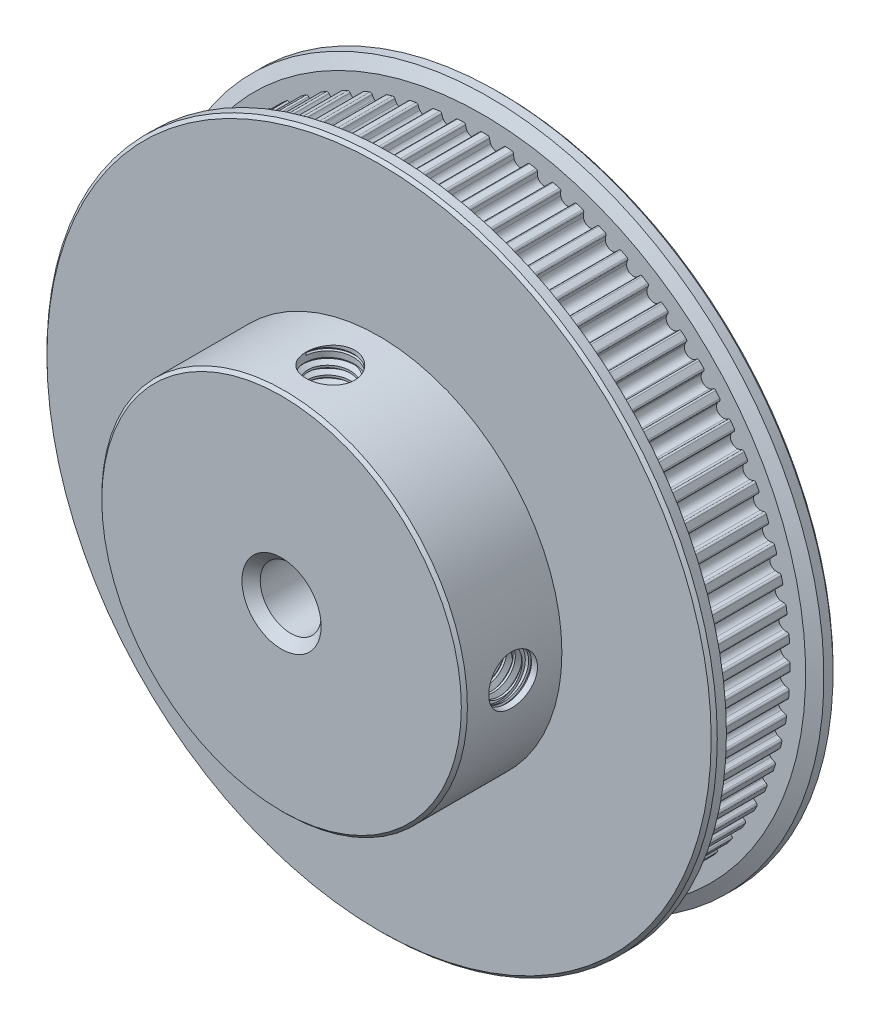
SolidWorks part; units mm, degrees
other "Markup1"
sketch "Sketch5" plane through (27.5, 27.5, 15) normal (0.951, 0.3087, 0.0178) x (0.0998, -0.2518, -0.9626)
ref_plane "Front Plane" through (0, 0, 0) normal (0, 0, 1) x (1, 0, 0)
ref_plane "Top Plane" through (0, 0, 0) normal (0, 1, 0) x (1, 0, 0)
ref_plane "Right Plane" through (0, 0, 0) normal (1, 0, 0) x (0, 0, -1)
sketch "Sketch1" plane through (0, 0, 0) normal (0, 0, 1) x (1, 0, 0)
  circle B0 centre (0, 0) radius 2.5
  arc B1 (17.8991, -17.7708) -> (17.9055, -17.573) centre (17.7897, -17.6683) ccw
  arc B2 (17.7274, -17.2894) -> (17.9055, -17.573) centre (18.6514, -16.9069) ccw
  arc B3 (17.843, -16.7174) -> (17.7274, -17.2894) centre (18.248, -17.0968) ccw
  arc B4 (18.4062, -16.5649) -> (17.843, -16.7174) centre (18.248, -17.0968) ccw
  arc B5 (18.7008, -16.7241) -> (18.4062, -16.5649) centre (18.0847, -17.5118) ccw
  arc B6 (18.7008, -16.7241) -> (18.8978, -16.7049) centre (18.7884, -16.6023) ccw
  arc B7 (18.8978, -16.7049) -> (19.2382, -16.3117) centre (0.0089, -0.0077) ccw
  arc B8 (19.2382, -16.3117) -> (19.2291, -16.114) centre (19.1211, -16.218) ccw
  arc B9 (19.0293, -15.8452) -> (19.2291, -16.114) centre (19.9204, -15.3914) ccw
  arc B10 (19.0996, -15.2659) -> (19.0293, -15.8452) centre (19.5331, -15.6124) ccw
  arc B11 (19.6492, -15.0697) -> (19.0996, -15.2659) centre (19.5331, -15.6124) ccw
  arc B12 (19.9553, -15.2053) -> (19.6492, -15.0697) centre (19.4029, -16.0389) ccw
  arc B13 (19.9553, -15.2053) -> (20.1502, -15.1707) centre (20.0331, -15.077) ccw
  arc B14 (20.1502, -15.1707) -> (20.4587, -14.752) centre (0.0095, -0.007) ccw
  arc B15 (20.4587, -14.752) -> (20.4341, -14.5556) centre (20.3346, -14.6678) ccw
  arc B16 (20.2138, -14.3033) -> (20.4341, -14.5556) centre (21.0666, -13.781) ccw
  arc B17 (20.2385, -13.7203) -> (20.2138, -14.3033) centre (20.6978, -14.0317) ccw
  arc B18 (20.7709, -13.4816) -> (20.2385, -13.7203) centre (20.6978, -14.0317) ccw
  arc B19 (21.0868, -13.5928) -> (20.7709, -13.4816) centre (20.6015, -14.4671) ccw
  arc B20 (21.0868, -13.5928) -> (21.2784, -13.5429) centre (21.1542, -13.4588) ccw
  arc B21 (21.2784, -13.5429) -> (21.5531, -13.1013) centre (0.0101, -0.0063) ccw
  arc B22 (21.5531, -13.1013) -> (21.5131, -12.9075) centre (21.4227, -13.0272) ccw
  arc B23 (21.2738, -12.6733) -> (21.5131, -12.9075) centre (22.0829, -12.0857) ccw
  arc B24 (21.2525, -12.0901) -> (21.2738, -12.6733) centre (21.7349, -12.3645) ccw
  arc B25 (21.7647, -11.8103) -> (21.2525, -12.0901) centre (21.7349, -12.3645) ccw
  arc B26 (22.0883, -11.8964) -> (21.7647, -11.8103) centre (21.673, -12.8061) ccw
  arc B27 (22.0883, -11.8964) -> (22.2754, -11.8317) centre (22.145, -11.7575) ccw
  arc B28 (22.2754, -11.8317) -> (22.5146, -11.3699) centre (0.0105, -0.0054) ccw
  arc B29 (22.5146, -11.3699) -> (22.4595, -11.1798) centre (22.3788, -11.3062) ccw
  arc B30 (22.2025, -10.9651) -> (22.4595, -11.1798) centre (22.963, -10.3158) ccw
  arc B31 (22.1356, -10.3854) -> (22.2025, -10.9651) centre (22.6381, -10.6211) ccw
  arc B32 (22.6242, -10.0663) -> (22.1356, -10.3854) centre (22.6381, -10.6211) ccw
  arc B33 (22.9536, -10.1267) -> (22.6242, -10.0663) centre (22.611, -11.0662) ccw
  arc B34 (22.9536, -10.1267) -> (23.135, -10.0475) centre (22.9992, -9.9838) ccw
  arc B35 (23.135, -10.0475) -> (23.3372, -9.5684) centre (0.0109, -0.0046) ccw
  arc B36 (23.3372, -9.5684) -> (23.2674, -9.3832) centre (23.1969, -9.5155) ccw
  arc B37 (22.9944, -9.1893) -> (23.2674, -9.3832) centre (23.7016, -8.4823) ccw
  arc B38 (22.8822, -8.6166) -> (22.9944, -9.1893) centre (23.4016, -8.8122) ccw
  arc B39 (23.3442, -8.2602) -> (22.8822, -8.6166) centre (23.4016, -8.8122) ccw
  arc B40 (23.6774, -8.2946) -> (23.3442, -8.2602) centre (23.4095, -9.258) ccw
  arc B41 (23.6774, -8.2946) -> (23.852, -8.2014) centre (23.7116, -8.1485) ccw
  arc B42 (23.852, -8.2014) -> (24.016, -7.7079) centre (0.0112, -0.0037) ccw
  arc B43 (24.016, -7.7079) -> (23.9319, -7.5287) centre (23.8719, -7.6662) ccw
  arc B44 (23.6445, -7.3569) -> (23.9319, -7.5287) centre (24.2941, -6.5966) ccw
  arc B45 (23.4877, -6.7947) -> (23.6445, -7.3569) centre (24.0209, -6.949) ccw
  arc B46 (23.9204, -6.4031) -> (23.4877, -6.7947) centre (24.0209, -6.949) ccw
  arc B47 (24.2552, -6.4113) -> (23.9204, -6.4031) centre (24.0637, -7.3928) ccw
  arc B48 (24.2552, -6.4113) -> (24.4219, -6.3047) centre (24.2779, -6.263) ccw
  arc B49 (24.4219, -6.3047) -> (24.5467, -5.7998) centre (0.0115, -0.0028) ccw
  arc B50 (24.5467, -5.7998) -> (24.4488, -5.6278) centre (24.3998, -5.7696) ccw
  arc B51 (24.1488, -5.4791) -> (24.4488, -5.6278) centre (24.7367, -4.6702) ccw
  arc B52 (23.9484, -4.931) -> (24.1488, -5.4791) centre (24.492, -5.0429) ccw
  arc B53 (24.349, -4.5066) -> (23.9484, -4.931) centre (24.492, -5.0429) ccw
  arc B54 (24.6834, -4.4885) -> (24.349, -4.5066) centre (24.5696, -5.482) ccw
  arc B55 (24.6834, -4.4885) -> (24.8413, -4.3692) centre (24.6944, -4.3389) ccw
  arc B56 (24.8413, -4.3692) -> (24.9261, -3.856) centre (0.0117, -0.0019) ccw
  arc B57 (24.9261, -3.856) -> (24.815, -3.6922) centre (24.7773, -3.8374) ccw
  arc B58 (24.5042, -3.5675) -> (24.815, -3.6922) centre (25.0269, -2.7149) ccw
  arc B59 (24.2615, -3.0368) -> (24.5042, -3.5675) centre (24.8122, -3.1057) ccw
  arc B60 (24.6275, -2.5823) -> (24.2615, -3.0368) centre (24.8122, -3.1057) ccw
  arc B61 (24.9595, -2.538) -> (24.6275, -2.5823) centre (24.924, -3.5374) ccw
  arc B62 (24.9595, -2.538) -> (25.1075, -2.4067) centre (24.9587, -2.388) ccw
  arc B63 (25.1075, -2.4067) -> (25.1518, -1.8885) centre (0.0118, -0.001) ccw
  arc B64 (25.1518, -1.8885) -> (25.0282, -1.7339) centre (25.002, -1.8816) ccw
  arc B65 (24.7086, -1.6339) -> (25.0282, -1.7339) centre (25.1628, -0.743) ccw
  arc B66 (24.4249, -1.1239) -> (24.7086, -1.6339) centre (24.9794, -1.1494) ccw
  arc B67 (24.7542, -0.6421) -> (24.4249, -1.1239) centre (24.9794, -1.1494) ccw
  arc B68 (25.0817, -0.5719) -> (24.7542, -0.6421) centre (25.1247, -1.571) ccw
  arc B69 (25.0817, -0.5719) -> (25.219, -0.4293) centre (25.0691, -0.4224) ccw
  arc B70 (25.219, -0.4293) -> (25.2225, 0.0907) centre (0.0118, -0.0001) ccw
  arc B71 (25.2225, 0.0907) -> (25.0871, 0.2352) centre (25.0725, 0.0859) ccw
  arc B72 (24.7606, 0.3098) -> (25.0871, 0.2352) centre (25.1435, 1.2336) ccw
  arc B73 (24.4378, 0.7959) -> (24.7606, 0.3098) centre (24.9925, 0.814) ccw
  arc B74 (24.7283, 1.302) -> (24.4378, 0.7959) centre (24.9925, 0.814) ccw
  arc B75 (25.0492, 1.3977) -> (24.7283, 1.302) centre (25.1705, 0.4051) ccw
  arc B76 (25.0492, 1.3977) -> (25.1749, 1.5507) centre (25.025, 1.5458) ccw
  arc B77 (25.1749, 1.5507) -> (25.1376, 2.0694) centre (0.0118, 0.0008) ccw
  arc B78 (25.1376, 2.0694) -> (24.9913, 2.2027) centre (24.9885, 2.0528) ccw
  arc B79 (24.66, 2.2515) -> (24.9913, 2.2027) centre (24.9692, 3.2025) ccw
  arc B80 (24.3001, 2.7108) -> (24.66, 2.2515) centre (24.8516, 2.7724) ccw
  arc B81 (24.5499, 3.2382) -> (24.3001, 2.7108) centre (24.8516, 2.7724) ccw
  arc B82 (24.8623, 3.3588) -> (24.5499, 3.2382) centre (25.0611, 2.3787) ccw
  arc B83 (24.8623, 3.3588) -> (24.9756, 3.5211) centre (24.8266, 3.5044) ccw
  arc B84 (24.9756, 3.5211) -> (24.8977, 4.0353) centre (0.0117, 0.0018) ccw
  arc B85 (24.8977, 4.0353) -> (24.7414, 4.1567) centre (24.7504, 4.007) ccw
  arc B86 (24.4073, 4.1794) -> (24.7414, 4.1567) centre (24.641, 5.1517) ccw
  arc B87 (24.0125, 4.609) -> (24.4073, 4.1794) centre (24.5575, 4.7137) ccw
  arc B88 (24.2202, 5.1544) -> (24.0125, 4.609) centre (24.5575, 4.7137) ccw
  arc B89 (24.5222, 5.2991) -> (24.2202, 5.1544) centre (24.7972, 4.3377) ccw
  arc B90 (24.5222, 5.2991) -> (24.6224, 5.4698) centre (24.4751, 5.4415) ccw
  arc B91 (24.6224, 5.4698) -> (24.5044, 5.9763) centre (0.0115, 0.0027) ccw
  arc B92 (24.5044, 5.9763) -> (24.339, 6.0851) centre (24.3597, 5.9366) ccw
  arc B93 (24.0042, 6.0815) -> (24.339, 6.0851) centre (24.1608, 7.0691) ccw
  arc B94 (23.5768, 6.4788) -> (24.0042, 6.0815) centre (24.112, 6.6259) ccw
  arc B95 (23.7411, 7.0388) -> (23.5768, 6.4788) centre (24.112, 6.6259) ccw
  arc B96 (24.0308, 7.2067) -> (23.7411, 7.0388) centre (24.3804, 6.2699) ccw
  arc B97 (24.0308, 7.2067) -> (24.1173, 7.3848) centre (23.9727, 7.345) ccw
  arc B98 (24.1173, 7.3848) -> (23.9599, 7.8805) centre (0.0113, 0.0036) ccw
  arc B99 (23.9599, 7.8805) -> (23.7866, 7.976) centre (23.8189, 7.8295) ccw
  arc B100 (23.453, 7.9461) -> (23.7866, 7.976) centre (23.5317, 8.943) ccw
  arc B101 (22.9958, 8.3087) -> (23.453, 7.9461) centre (23.5178, 8.4973) ccw
  arc B102 (23.1157, 8.8798) -> (22.9958, 8.3087) centre (23.5178, 8.4973) ccw
  arc B103 (23.3913, 9.07) -> (23.1157, 8.8798) centre (23.8134, 8.1634) ccw
  arc B104 (23.3913, 9.07) -> (23.4636, 9.2542) centre (23.3225, 9.2033) ccw
  arc B105 (23.4636, 9.2542) -> (23.2678, 9.7361) centre (0.011, 0.0045) ccw
  arc B106 (23.2678, 9.7361) -> (23.0875, 9.8177) centre (23.1312, 9.6742) ccw
  arc B107 (22.7573, 9.7617) -> (23.0875, 9.8177) centre (22.7575, 10.7617) ccw
  arc B108 (22.273, 10.0873) -> (22.7573, 9.7617) centre (22.7786, 10.3163) ccw
  arc B109 (22.3477, 10.666) -> (22.273, 10.0873) centre (22.7786, 10.3163) ccw
  arc B110 (22.6076, 10.8773) -> (22.3477, 10.666) centre (23.0995, 10.0066) ccw
  arc B111 (22.6076, 10.8773) -> (22.6652, 11.0666) centre (22.5285, 11.0048) ccw
  arc B112 (22.6652, 11.0666) -> (22.4322, 11.5316) centre (0.0106, 0.0053) ccw
  arc B113 (22.4322, 11.5316) -> (22.246, 11.5988) centre (22.3008, 11.4592) ccw
  arc B114 (21.9213, 11.5171) -> (22.246, 11.5988) centre (21.843, 12.514) ccw
  arc B115 (21.4129, 11.8037) -> (21.9213, 11.5171) centre (21.899, 12.0716) ccw
  arc B116 (21.442, 12.3865) -> (21.4129, 11.8037) centre (21.899, 12.0716) ccw
  arc B117 (21.6845, 12.6175) -> (21.442, 12.3865) centre (22.2431, 11.7881) ccw
  arc B118 (21.6845, 12.6175) -> (21.727, 12.8108) centre (21.5957, 12.7384) ccw
  arc B119 (21.727, 12.8108) -> (21.4583, 13.2561) centre (0.0101, 0.0061) ccw
  arc B120 (21.4583, 13.2561) -> (21.2674, 13.3085) centre (21.333, 13.1736) ccw
  arc B121 (20.9501, 13.2015) -> (21.2674, 13.3085) centre (20.7938, 14.1892) ccw
  arc B122 (20.4208, 13.4474) -> (20.9501, 13.2015) centre (20.8843, 13.7526) ccw
  arc B123 (20.404, 14.0307) -> (20.4208, 13.4474) centre (20.8843, 13.7526) ccw
  arc B124 (20.6277, 14.28) -> (20.404, 14.0307) centre (21.2497, 13.497) ccw
  arc B125 (20.6277, 14.28) -> (20.6549, 14.476) centre (20.5297, 14.3935) ccw
  arc B126 (20.6549, 14.476) -> (20.3521, 14.8988) centre (0.0096, 0.0069) ccw
  arc B127 (20.3521, 14.8988) -> (20.1577, 14.9361) centre (20.2336, 14.8067) ccw
  arc B128 (19.8497, 14.8045) -> (20.1577, 14.9361) centre (19.6164, 15.7769) ccw
  arc B129 (19.3028, 15.0081) -> (19.8497, 14.8045) centre (19.7409, 15.3488) ccw
  arc B130 (19.2403, 15.5883) -> (19.3028, 15.0081) centre (19.7409, 15.3488) ccw
  arc B131 (19.4437, 15.8544) -> (19.2403, 15.5883) centre (20.1252, 15.1226) ccw
  arc B132 (19.4437, 15.8544) -> (19.4555, 16.0519) centre (19.3371, 15.9599) ccw
  arc B133 (19.4555, 16.0519) -> (19.1204, 16.4497) centre (0.0091, 0.0076) ccw
  arc B134 (19.1204, 16.4497) -> (18.9237, 16.4716) centre (19.0095, 16.3486) ccw
  arc B135 (18.627, 16.3163) -> (18.9237, 16.4716) centre (18.3181, 17.2674) ccw
  arc B136 (18.0658, 16.4763) -> (18.627, 16.3163) centre (18.4758, 16.8503) ccw
  arc B137 (17.9579, 17.0498) -> (18.0658, 16.4763) centre (18.4758, 16.8503) ccw
  arc B138 (18.1398, 17.331) -> (17.9579, 17.0498) centre (18.8767, 16.655) ccw
  arc B139 (18.1398, 17.331) -> (18.1361, 17.5289) centre (18.0253, 17.4278) ccw
  arc B140 (18.1361, 17.5289) -> (17.7708, 17.8991) centre (0.0084, 0.0083) ccw
  arc B141 (17.7708, 17.8991) -> (17.573, 17.9055) centre (17.6683, 17.7897) ccw
  arc B142 (17.2894, 17.7274) -> (17.573, 17.9055) centre (16.9069, 18.6514) ccw
  arc B143 (16.7174, 17.843) -> (17.2894, 17.7274) centre (17.0968, 18.248) ccw
  arc B144 (16.5649, 18.4062) -> (16.7174, 17.843) centre (17.0968, 18.248) ccw
  arc B145 (16.7241, 18.7008) -> (16.5649, 18.4062) centre (17.5118, 18.0847) ccw
  arc B146 (16.7241, 18.7008) -> (16.7049, 18.8978) centre (16.6023, 18.7884) ccw
  arc B147 (16.7049, 18.8978) -> (16.3117, 19.2382) centre (0.0077, 0.0089) ccw
  arc B148 (16.3117, 19.2382) -> (16.114, 19.2291) centre (16.218, 19.1211) ccw
  arc B149 (15.8452, 19.0293) -> (16.114, 19.2291) centre (15.3914, 19.9204) ccw
  arc B150 (15.2659, 19.0996) -> (15.8452, 19.0293) centre (15.6124, 19.5331) ccw
  arc B151 (15.0697, 19.6492) -> (15.2659, 19.0996) centre (15.6124, 19.5331) ccw
  arc B152 (15.2053, 19.9553) -> (15.0697, 19.6492) centre (16.0389, 19.4029) ccw
  arc B153 (15.2053, 19.9553) -> (15.1707, 20.1502) centre (15.077, 20.0331) ccw
  arc B154 (15.1707, 20.1502) -> (14.752, 20.4587) centre (0.007, 0.0095) ccw
  arc B155 (14.752, 20.4587) -> (14.5556, 20.4341) centre (14.6678, 20.3346) ccw
  arc B156 (14.3033, 20.2138) -> (14.5556, 20.4341) centre (13.781, 21.0666) ccw
  arc B157 (13.7203, 20.2385) -> (14.3033, 20.2138) centre (14.0317, 20.6978) ccw
  arc B158 (13.4816, 20.7709) -> (13.7203, 20.2385) centre (14.0317, 20.6978) ccw
  arc B159 (13.5928, 21.0868) -> (13.4816, 20.7709) centre (14.4671, 20.6015) ccw
  arc B160 (13.5928, 21.0868) -> (13.5429, 21.2784) centre (13.4588, 21.1542) ccw
  arc B161 (13.5429, 21.2784) -> (13.1013, 21.5531) centre (0.0063, 0.0101) ccw
  arc B162 (13.1013, 21.5531) -> (12.9075, 21.5131) centre (13.0272, 21.4227) ccw
  arc B163 (12.6733, 21.2738) -> (12.9075, 21.5131) centre (12.0857, 22.0829) ccw
  arc B164 (12.0901, 21.2525) -> (12.6733, 21.2738) centre (12.3645, 21.7349) ccw
  arc B165 (11.8103, 21.7647) -> (12.0901, 21.2525) centre (12.3645, 21.7349) ccw
  arc B166 (11.8964, 22.0883) -> (11.8103, 21.7647) centre (12.8061, 21.673) ccw
  arc B167 (11.8964, 22.0883) -> (11.8317, 22.2754) centre (11.7575, 22.145) ccw
  arc B168 (11.8317, 22.2754) -> (11.3699, 22.5146) centre (0.0054, 0.0105) ccw
  arc B169 (11.3699, 22.5146) -> (11.1798, 22.4595) centre (11.3062, 22.3788) ccw
  arc B170 (10.9651, 22.2025) -> (11.1798, 22.4595) centre (10.3158, 22.963) ccw
  arc B171 (10.3854, 22.1356) -> (10.9651, 22.2025) centre (10.6211, 22.6381) ccw
  arc B172 (10.0663, 22.6242) -> (10.3854, 22.1356) centre (10.6211, 22.6381) ccw
  arc B173 (10.1267, 22.9536) -> (10.0663, 22.6242) centre (11.0662, 22.611) ccw
  arc B174 (10.1267, 22.9536) -> (10.0475, 23.135) centre (9.9838, 22.9992) ccw
  arc B175 (10.0475, 23.135) -> (9.5684, 23.3372) centre (0.0046, 0.0109) ccw
  arc B176 (9.5684, 23.3372) -> (9.3832, 23.2674) centre (9.5155, 23.1969) ccw
  arc B177 (9.1893, 22.9944) -> (9.3832, 23.2674) centre (8.4823, 23.7016) ccw
  arc B178 (8.6166, 22.8822) -> (9.1893, 22.9944) centre (8.8122, 23.4016) ccw
  arc B179 (8.2602, 23.3442) -> (8.6166, 22.8822) centre (8.8122, 23.4016) ccw
  arc B180 (8.2946, 23.6774) -> (8.2602, 23.3442) centre (9.258, 23.4095) ccw
  arc B181 (8.2946, 23.6774) -> (8.2014, 23.852) centre (8.1485, 23.7116) ccw
  arc B182 (8.2014, 23.852) -> (7.7079, 24.016) centre (0.0037, 0.0112) ccw
  arc B183 (7.7079, 24.016) -> (7.5287, 23.9319) centre (7.6662, 23.8719) ccw
  arc B184 (7.3569, 23.6445) -> (7.5287, 23.9319) centre (6.5966, 24.2941) ccw
  arc B185 (6.7947, 23.4877) -> (7.3569, 23.6445) centre (6.949, 24.0209) ccw
  arc B186 (6.4031, 23.9204) -> (6.7947, 23.4877) centre (6.949, 24.0209) ccw
  arc B187 (6.4113, 24.2552) -> (6.4031, 23.9204) centre (7.3928, 24.0637) ccw
  arc B188 (6.4113, 24.2552) -> (6.3047, 24.4219) centre (6.263, 24.2779) ccw
  arc B189 (6.3047, 24.4219) -> (5.7998, 24.5467) centre (0.0028, 0.0115) ccw
  arc B190 (5.7998, 24.5467) -> (5.6278, 24.4488) centre (5.7696, 24.3998) ccw
  arc B191 (5.4791, 24.1488) -> (5.6278, 24.4488) centre (4.6702, 24.7367) ccw
  arc B192 (4.931, 23.9484) -> (5.4791, 24.1488) centre (5.0429, 24.492) ccw
  arc B193 (4.5066, 24.349) -> (4.931, 23.9484) centre (5.0429, 24.492) ccw
  arc B194 (4.4885, 24.6834) -> (4.5066, 24.349) centre (5.482, 24.5696) ccw
  arc B195 (4.4885, 24.6834) -> (4.3692, 24.8413) centre (4.3389, 24.6944) ccw
  arc B196 (4.3692, 24.8413) -> (3.856, 24.9261) centre (0.0019, 0.0117) ccw
  arc B197 (3.856, 24.9261) -> (3.6922, 24.815) centre (3.8374, 24.7773) ccw
  arc B198 (3.5675, 24.5042) -> (3.6922, 24.815) centre (2.7149, 25.0269) ccw
  arc B199 (3.0368, 24.2615) -> (3.5675, 24.5042) centre (3.1057, 24.8122) ccw
  arc B200 (2.5823, 24.6275) -> (3.0368, 24.2615) centre (3.1057, 24.8122) ccw
  arc B201 (2.538, 24.9595) -> (2.5823, 24.6275) centre (3.5374, 24.924) ccw
  arc B202 (2.538, 24.9595) -> (2.4067, 25.1075) centre (2.388, 24.9587) ccw
  arc B203 (2.4067, 25.1075) -> (1.8885, 25.1518) centre (0.001, 0.0118) ccw
  arc B204 (1.8885, 25.1518) -> (1.7339, 25.0282) centre (1.8816, 25.002) ccw
  arc B205 (1.6339, 24.7086) -> (1.7339, 25.0282) centre (0.743, 25.1628) ccw
  arc B206 (1.1239, 24.4249) -> (1.6339, 24.7086) centre (1.1494, 24.9794) ccw
  arc B207 (0.6421, 24.7542) -> (1.1239, 24.4249) centre (1.1494, 24.9794) ccw
  arc B208 (0.5719, 25.0817) -> (0.6421, 24.7542) centre (1.571, 25.1247) ccw
  arc B209 (0.5719, 25.0817) -> (0.4293, 25.219) centre (0.4224, 25.0691) ccw
  arc B210 (0.4293, 25.219) -> (-0.0907, 25.2225) centre (0.0001, 0.0118) ccw
  arc B211 (-0.0907, 25.2225) -> (-0.2352, 25.0871) centre (-0.0859, 25.0725) ccw
  arc B212 (-0.3098, 24.7606) -> (-0.2352, 25.0871) centre (-1.2336, 25.1435) ccw
  arc B213 (-0.7959, 24.4378) -> (-0.3098, 24.7606) centre (-0.814, 24.9925) ccw
  arc B214 (-1.302, 24.7283) -> (-0.7959, 24.4378) centre (-0.814, 24.9925) ccw
  arc B215 (-1.3977, 25.0492) -> (-1.302, 24.7283) centre (-0.4051, 25.1705) ccw
  arc B216 (-1.3977, 25.0492) -> (-1.5507, 25.1749) centre (-1.5458, 25.025) ccw
  arc B217 (-1.5507, 25.1749) -> (-2.0694, 25.1376) centre (-0.0008, 0.0118) ccw
  arc B218 (-2.0694, 25.1376) -> (-2.2027, 24.9913) centre (-2.0528, 24.9885) ccw
  arc B219 (-2.2515, 24.66) -> (-2.2027, 24.9913) centre (-3.2025, 24.9692) ccw
  arc B220 (-2.7108, 24.3001) -> (-2.2515, 24.66) centre (-2.7724, 24.8516) ccw
  arc B221 (-3.2382, 24.5499) -> (-2.7108, 24.3001) centre (-2.7724, 24.8516) ccw
  arc B222 (-3.3588, 24.8623) -> (-3.2382, 24.5499) centre (-2.3787, 25.0611) ccw
  arc B223 (-3.3588, 24.8623) -> (-3.5211, 24.9756) centre (-3.5044, 24.8266) ccw
  arc B224 (-3.5211, 24.9756) -> (-4.0353, 24.8977) centre (-0.0018, 0.0117) ccw
  arc B225 (-4.0353, 24.8977) -> (-4.1567, 24.7414) centre (-4.007, 24.7504) ccw
  arc B226 (-4.1794, 24.4073) -> (-4.1567, 24.7414) centre (-5.1517, 24.641) ccw
  arc B227 (-4.609, 24.0125) -> (-4.1794, 24.4073) centre (-4.7137, 24.5575) ccw
  arc B228 (-5.1544, 24.2202) -> (-4.609, 24.0125) centre (-4.7137, 24.5575) ccw
  arc B229 (-5.2991, 24.5222) -> (-5.1544, 24.2202) centre (-4.3377, 24.7972) ccw
  arc B230 (-5.2991, 24.5222) -> (-5.4698, 24.6224) centre (-5.4415, 24.4751) ccw
  arc B231 (-5.4698, 24.6224) -> (-5.9763, 24.5044) centre (-0.0027, 0.0115) ccw
  arc B232 (-5.9763, 24.5044) -> (-6.0851, 24.339) centre (-5.9366, 24.3597) ccw
  arc B233 (-6.0815, 24.0042) -> (-6.0851, 24.339) centre (-7.0691, 24.1608) ccw
  arc B234 (-6.4788, 23.5768) -> (-6.0815, 24.0042) centre (-6.6259, 24.112) ccw
  arc B235 (-7.0388, 23.7411) -> (-6.4788, 23.5768) centre (-6.6259, 24.112) ccw
  arc B236 (-7.2067, 24.0308) -> (-7.0388, 23.7411) centre (-6.2699, 24.3804) ccw
  arc B237 (-7.2067, 24.0308) -> (-7.3848, 24.1173) centre (-7.345, 23.9727) ccw
  arc B238 (-7.3848, 24.1173) -> (-7.8805, 23.9599) centre (-0.0036, 0.0113) ccw
  arc B239 (-7.8805, 23.9599) -> (-7.976, 23.7866) centre (-7.8295, 23.8189) ccw
  arc B240 (-7.9461, 23.453) -> (-7.976, 23.7866) centre (-8.943, 23.5317) ccw
  arc B241 (-8.3087, 22.9958) -> (-7.9461, 23.453) centre (-8.4973, 23.5178) ccw
  arc B242 (-8.8798, 23.1157) -> (-8.3087, 22.9958) centre (-8.4973, 23.5178) ccw
  arc B243 (-9.07, 23.3913) -> (-8.8798, 23.1157) centre (-8.1634, 23.8134) ccw
  arc B244 (-9.07, 23.3913) -> (-9.2542, 23.4636) centre (-9.2033, 23.3225) ccw
  arc B245 (-9.2542, 23.4636) -> (-9.7361, 23.2678) centre (-0.0045, 0.011) ccw
  arc B246 (-9.7361, 23.2678) -> (-9.8177, 23.0875) centre (-9.6742, 23.1312) ccw
  arc B247 (-9.7617, 22.7573) -> (-9.8177, 23.0875) centre (-10.7617, 22.7575) ccw
  arc B248 (-10.0873, 22.273) -> (-9.7617, 22.7573) centre (-10.3163, 22.7786) ccw
  arc B249 (-10.666, 22.3477) -> (-10.0873, 22.273) centre (-10.3163, 22.7786) ccw
  arc B250 (-10.8773, 22.6076) -> (-10.666, 22.3477) centre (-10.0066, 23.0995) ccw
  arc B251 (-10.8773, 22.6076) -> (-11.0666, 22.6652) centre (-11.0048, 22.5285) ccw
  arc B252 (-11.0666, 22.6652) -> (-11.5316, 22.4322) centre (-0.0053, 0.0106) ccw
  arc B253 (-11.5316, 22.4322) -> (-11.5988, 22.246) centre (-11.4592, 22.3008) ccw
  arc B254 (-11.5171, 21.9213) -> (-11.5988, 22.246) centre (-12.514, 21.843) ccw
  arc B255 (-11.8037, 21.4129) -> (-11.5171, 21.9213) centre (-12.0716, 21.899) ccw
  arc B256 (-12.3865, 21.442) -> (-11.8037, 21.4129) centre (-12.0716, 21.899) ccw
  arc B257 (-12.6175, 21.6845) -> (-12.3865, 21.442) centre (-11.7881, 22.2431) ccw
  arc B258 (-12.6175, 21.6845) -> (-12.8108, 21.727) centre (-12.7384, 21.5957) ccw
  arc B259 (-12.8108, 21.727) -> (-13.2561, 21.4583) centre (-0.0061, 0.0101) ccw
  arc B260 (-13.2561, 21.4583) -> (-13.3085, 21.2674) centre (-13.1736, 21.333) ccw
  arc B261 (-13.2015, 20.9501) -> (-13.3085, 21.2674) centre (-14.1892, 20.7938) ccw
  arc B262 (-13.4474, 20.4208) -> (-13.2015, 20.9501) centre (-13.7526, 20.8843) ccw
  arc B263 (-14.0307, 20.404) -> (-13.4474, 20.4208) centre (-13.7526, 20.8843) ccw
  arc B264 (-14.28, 20.6277) -> (-14.0307, 20.404) centre (-13.497, 21.2497) ccw
  arc B265 (-14.28, 20.6277) -> (-14.476, 20.6549) centre (-14.3935, 20.5297) ccw
  arc B266 (-14.476, 20.6549) -> (-14.8988, 20.3521) centre (-0.0069, 0.0096) ccw
  arc B267 (-14.8988, 20.3521) -> (-14.9361, 20.1577) centre (-14.8067, 20.2336) ccw
  arc B268 (-14.8045, 19.8497) -> (-14.9361, 20.1577) centre (-15.7769, 19.6164) ccw
  arc B269 (-15.0081, 19.3028) -> (-14.8045, 19.8497) centre (-15.3488, 19.7409) ccw
  arc B270 (-15.5883, 19.2403) -> (-15.0081, 19.3028) centre (-15.3488, 19.7409) ccw
  arc B271 (-15.8544, 19.4437) -> (-15.5883, 19.2403) centre (-15.1226, 20.1252) ccw
  arc B272 (-15.8544, 19.4437) -> (-16.0519, 19.4555) centre (-15.9599, 19.3371) ccw
  arc B273 (-16.0519, 19.4555) -> (-16.4497, 19.1204) centre (-0.0076, 0.0091) ccw
  arc B274 (-16.4497, 19.1204) -> (-16.4716, 18.9237) centre (-16.3486, 19.0095) ccw
  arc B275 (-16.3163, 18.627) -> (-16.4716, 18.9237) centre (-17.2674, 18.3181) ccw
  arc B276 (-16.4763, 18.0658) -> (-16.3163, 18.627) centre (-16.8503, 18.4758) ccw
  arc B277 (-17.0498, 17.9579) -> (-16.4763, 18.0658) centre (-16.8503, 18.4758) ccw
  arc B278 (-17.331, 18.1398) -> (-17.0498, 17.9579) centre (-16.655, 18.8767) ccw
  arc B279 (-17.331, 18.1398) -> (-17.5289, 18.1361) centre (-17.4278, 18.0253) ccw
  arc B280 (-17.5289, 18.1361) -> (-17.8991, 17.7708) centre (-0.0083, 0.0084) ccw
  arc B281 (-17.8991, 17.7708) -> (-17.9055, 17.573) centre (-17.7897, 17.6683) ccw
  arc B282 (-17.7274, 17.2894) -> (-17.9055, 17.573) centre (-18.6514, 16.9069) ccw
  arc B283 (-17.843, 16.7174) -> (-17.7274, 17.2894) centre (-18.248, 17.0968) ccw
  arc B284 (-18.4062, 16.5649) -> (-17.843, 16.7174) centre (-18.248, 17.0968) ccw
  arc B285 (-18.7008, 16.7241) -> (-18.4062, 16.5649) centre (-18.0847, 17.5118) ccw
  arc B286 (-18.7008, 16.7241) -> (-18.8978, 16.7049) centre (-18.7884, 16.6023) ccw
  arc B287 (-18.8978, 16.7049) -> (-19.2382, 16.3117) centre (-0.0089, 0.0077) ccw
  arc B288 (-19.2382, 16.3117) -> (-19.2291, 16.114) centre (-19.1211, 16.218) ccw
  arc B289 (-19.0293, 15.8452) -> (-19.2291, 16.114) centre (-19.9204, 15.3914) ccw
  arc B290 (-19.0996, 15.2659) -> (-19.0293, 15.8452) centre (-19.5331, 15.6124) ccw
  arc B291 (-19.6492, 15.0697) -> (-19.0996, 15.2659) centre (-19.5331, 15.6124) ccw
  arc B292 (-19.9553, 15.2053) -> (-19.6492, 15.0697) centre (-19.4029, 16.0389) ccw
  arc B293 (-19.9553, 15.2053) -> (-20.1502, 15.1707) centre (-20.0331, 15.077) ccw
  arc B294 (-20.1502, 15.1707) -> (-20.4587, 14.752) centre (-0.0095, 0.007) ccw
  arc B295 (-20.4587, 14.752) -> (-20.4341, 14.5556) centre (-20.3346, 14.6678) ccw
  arc B296 (-20.2138, 14.3033) -> (-20.4341, 14.5556) centre (-21.0666, 13.781) ccw
  arc B297 (-20.2385, 13.7203) -> (-20.2138, 14.3033) centre (-20.6978, 14.0317) ccw
  arc B298 (-20.7709, 13.4816) -> (-20.2385, 13.7203) centre (-20.6978, 14.0317) ccw
  arc B299 (-21.0868, 13.5928) -> (-20.7709, 13.4816) centre (-20.6015, 14.4671) ccw
  arc B300 (-21.0868, 13.5928) -> (-21.2784, 13.5429) centre (-21.1542, 13.4588) ccw
  arc B301 (-21.2784, 13.5429) -> (-21.5531, 13.1013) centre (-0.0101, 0.0063) ccw
  arc B302 (-21.5531, 13.1013) -> (-21.5131, 12.9075) centre (-21.4227, 13.0272) ccw
  arc B303 (-21.2738, 12.6733) -> (-21.5131, 12.9075) centre (-22.0829, 12.0857) ccw
  arc B304 (-21.2525, 12.0901) -> (-21.2738, 12.6733) centre (-21.7349, 12.3645) ccw
  arc B305 (-21.7647, 11.8103) -> (-21.2525, 12.0901) centre (-21.7349, 12.3645) ccw
  arc B306 (-22.0883, 11.8964) -> (-21.7647, 11.8103) centre (-21.673, 12.8061) ccw
  arc B307 (-22.0883, 11.8964) -> (-22.2754, 11.8317) centre (-22.145, 11.7575) ccw
  arc B308 (-22.2754, 11.8317) -> (-22.5146, 11.3699) centre (-0.0105, 0.0054) ccw
  arc B309 (-22.5146, 11.3699) -> (-22.4595, 11.1798) centre (-22.3788, 11.3062) ccw
  arc B310 (-22.2025, 10.9651) -> (-22.4595, 11.1798) centre (-22.963, 10.3158) ccw
  arc B311 (-22.1356, 10.3854) -> (-22.2025, 10.9651) centre (-22.6381, 10.6211) ccw
  arc B312 (-22.6242, 10.0663) -> (-22.1356, 10.3854) centre (-22.6381, 10.6211) ccw
  arc B313 (-22.9536, 10.1267) -> (-22.6242, 10.0663) centre (-22.611, 11.0662) ccw
  arc B314 (-22.9536, 10.1267) -> (-23.135, 10.0475) centre (-22.9992, 9.9838) ccw
  arc B315 (-23.135, 10.0475) -> (-23.3372, 9.5684) centre (-0.0109, 0.0046) ccw
  arc B316 (-23.3372, 9.5684) -> (-23.2674, 9.3832) centre (-23.1969, 9.5155) ccw
  arc B317 (-22.9944, 9.1893) -> (-23.2674, 9.3832) centre (-23.7016, 8.4823) ccw
  arc B318 (-22.8822, 8.6166) -> (-22.9944, 9.1893) centre (-23.4016, 8.8122) ccw
  arc B319 (-23.3442, 8.2602) -> (-22.8822, 8.6166) centre (-23.4016, 8.8122) ccw
  arc B320 (-23.6774, 8.2946) -> (-23.3442, 8.2602) centre (-23.4095, 9.258) ccw
  arc B321 (-23.6774, 8.2946) -> (-23.852, 8.2014) centre (-23.7116, 8.1485) ccw
  arc B322 (-23.852, 8.2014) -> (-24.016, 7.7079) centre (-0.0112, 0.0037) ccw
  arc B323 (-24.016, 7.7079) -> (-23.9319, 7.5287) centre (-23.8719, 7.6662) ccw
  arc B324 (-23.6445, 7.3569) -> (-23.9319, 7.5287) centre (-24.2941, 6.5966) ccw
  arc B325 (-23.4877, 6.7947) -> (-23.6445, 7.3569) centre (-24.0209, 6.949) ccw
  arc B326 (-23.9204, 6.4031) -> (-23.4877, 6.7947) centre (-24.0209, 6.949) ccw
  arc B327 (-24.2552, 6.4113) -> (-23.9204, 6.4031) centre (-24.0637, 7.3928) ccw
  arc B328 (-24.2552, 6.4113) -> (-24.4219, 6.3047) centre (-24.2779, 6.263) ccw
  arc B329 (-24.4219, 6.3047) -> (-24.5467, 5.7998) centre (-0.0115, 0.0028) ccw
  arc B330 (-24.5467, 5.7998) -> (-24.4488, 5.6278) centre (-24.3998, 5.7696) ccw
  arc B331 (-24.1488, 5.4791) -> (-24.4488, 5.6278) centre (-24.7367, 4.6702) ccw
  arc B332 (-23.9484, 4.931) -> (-24.1488, 5.4791) centre (-24.492, 5.0429) ccw
  arc B333 (-24.349, 4.5066) -> (-23.9484, 4.931) centre (-24.492, 5.0429) ccw
  arc B334 (-24.6834, 4.4885) -> (-24.349, 4.5066) centre (-24.5696, 5.482) ccw
  arc B335 (-24.6834, 4.4885) -> (-24.8413, 4.3692) centre (-24.6944, 4.3389) ccw
  arc B336 (-24.8413, 4.3692) -> (-24.9261, 3.856) centre (-0.0117, 0.0019) ccw
  arc B337 (-24.9261, 3.856) -> (-24.815, 3.6922) centre (-24.7773, 3.8374) ccw
  arc B338 (-24.5042, 3.5675) -> (-24.815, 3.6922) centre (-25.0269, 2.7149) ccw
  arc B339 (-24.2615, 3.0368) -> (-24.5042, 3.5675) centre (-24.8122, 3.1057) ccw
  arc B340 (-24.6275, 2.5823) -> (-24.2615, 3.0368) centre (-24.8122, 3.1057) ccw
  arc B341 (-24.9595, 2.538) -> (-24.6275, 2.5823) centre (-24.924, 3.5374) ccw
  arc B342 (-24.9595, 2.538) -> (-25.1075, 2.4067) centre (-24.9587, 2.388) ccw
  arc B343 (-25.1075, 2.4067) -> (-25.1518, 1.8885) centre (-0.0118, 0.001) ccw
  arc B344 (-25.1518, 1.8885) -> (-25.0282, 1.7339) centre (-25.002, 1.8816) ccw
  arc B345 (-24.7086, 1.6339) -> (-25.0282, 1.7339) centre (-25.1628, 0.743) ccw
  arc B346 (-24.4249, 1.1239) -> (-24.7086, 1.6339) centre (-24.9794, 1.1494) ccw
  arc B347 (-24.7542, 0.6421) -> (-24.4249, 1.1239) centre (-24.9794, 1.1494) ccw
  arc B348 (-25.0817, 0.5719) -> (-24.7542, 0.6421) centre (-25.1247, 1.571) ccw
  arc B349 (-25.0817, 0.5719) -> (-25.219, 0.4293) centre (-25.0691, 0.4224) ccw
  arc B350 (-25.219, 0.4293) -> (-25.2225, -0.0907) centre (-0.0118, 0.0001) ccw
  arc B351 (-25.2225, -0.0907) -> (-25.0871, -0.2352) centre (-25.0725, -0.0859) ccw
  arc B352 (-24.7606, -0.3098) -> (-25.0871, -0.2352) centre (-25.1435, -1.2336) ccw
  arc B353 (-24.4378, -0.7959) -> (-24.7606, -0.3098) centre (-24.9925, -0.814) ccw
  arc B354 (-24.7283, -1.302) -> (-24.4378, -0.7959) centre (-24.9925, -0.814) ccw
  arc B355 (-25.0492, -1.3977) -> (-24.7283, -1.302) centre (-25.1705, -0.4051) ccw
  arc B356 (-25.0492, -1.3977) -> (-25.1749, -1.5507) centre (-25.025, -1.5458) ccw
  arc B357 (-25.1749, -1.5507) -> (-25.1376, -2.0694) centre (-0.0118, -0.0008) ccw
  arc B358 (-25.1376, -2.0694) -> (-24.9913, -2.2027) centre (-24.9885, -2.0528) ccw
  arc B359 (-24.66, -2.2515) -> (-24.9913, -2.2027) centre (-24.9692, -3.2025) ccw
  arc B360 (-24.3001, -2.7108) -> (-24.66, -2.2515) centre (-24.8516, -2.7724) ccw
  arc B361 (-24.5499, -3.2382) -> (-24.3001, -2.7108) centre (-24.8516, -2.7724) ccw
  arc B362 (-24.8623, -3.3588) -> (-24.5499, -3.2382) centre (-25.0611, -2.3787) ccw
  arc B363 (-24.8623, -3.3588) -> (-24.9756, -3.5211) centre (-24.8266, -3.5044) ccw
  arc B364 (-24.9756, -3.5211) -> (-24.8977, -4.0353) centre (-0.0117, -0.0018) ccw
  arc B365 (-24.8977, -4.0353) -> (-24.7414, -4.1567) centre (-24.7504, -4.007) ccw
  arc B366 (-24.4073, -4.1794) -> (-24.7414, -4.1567) centre (-24.641, -5.1517) ccw
  arc B367 (-24.0125, -4.609) -> (-24.4073, -4.1794) centre (-24.5575, -4.7137) ccw
  arc B368 (-24.2202, -5.1544) -> (-24.0125, -4.609) centre (-24.5575, -4.7137) ccw
  arc B369 (-24.5222, -5.2991) -> (-24.2202, -5.1544) centre (-24.7972, -4.3377) ccw
  arc B370 (-24.5222, -5.2991) -> (-24.6224, -5.4698) centre (-24.4751, -5.4415) ccw
  arc B371 (-24.6224, -5.4698) -> (-24.5044, -5.9763) centre (-0.0115, -0.0027) ccw
  arc B372 (-24.5044, -5.9763) -> (-24.339, -6.0851) centre (-24.3597, -5.9366) ccw
  arc B373 (-24.0042, -6.0815) -> (-24.339, -6.0851) centre (-24.1608, -7.0691) ccw
  arc B374 (-23.5768, -6.4788) -> (-24.0042, -6.0815) centre (-24.112, -6.6259) ccw
  arc B375 (-23.7411, -7.0388) -> (-23.5768, -6.4788) centre (-24.112, -6.6259) ccw
  arc B376 (-24.0308, -7.2067) -> (-23.7411, -7.0388) centre (-24.3804, -6.2699) ccw
  arc B377 (-24.0308, -7.2067) -> (-24.1173, -7.3848) centre (-23.9727, -7.345) ccw
  arc B378 (-24.1173, -7.3848) -> (-23.9599, -7.8805) centre (-0.0113, -0.0036) ccw
  arc B379 (-23.9599, -7.8805) -> (-23.7866, -7.976) centre (-23.8189, -7.8295) ccw
  arc B380 (-23.453, -7.9461) -> (-23.7866, -7.976) centre (-23.5317, -8.943) ccw
  arc B381 (-22.9958, -8.3087) -> (-23.453, -7.9461) centre (-23.5178, -8.4973) ccw
  arc B382 (-23.1157, -8.8798) -> (-22.9958, -8.3087) centre (-23.5178, -8.4973) ccw
  arc B383 (-23.3913, -9.07) -> (-23.1157, -8.8798) centre (-23.8134, -8.1634) ccw
  arc B384 (-23.3913, -9.07) -> (-23.4636, -9.2542) centre (-23.3225, -9.2033) ccw
  arc B385 (-23.4636, -9.2542) -> (-23.2678, -9.7361) centre (-0.011, -0.0045) ccw
  arc B386 (-23.2678, -9.7361) -> (-23.0875, -9.8177) centre (-23.1312, -9.6742) ccw
  arc B387 (-22.7573, -9.7617) -> (-23.0875, -9.8177) centre (-22.7575, -10.7617) ccw
  arc B388 (-22.273, -10.0873) -> (-22.7573, -9.7617) centre (-22.7786, -10.3163) ccw
  arc B389 (-22.3477, -10.666) -> (-22.273, -10.0873) centre (-22.7786, -10.3163) ccw
  arc B390 (-22.6076, -10.8773) -> (-22.3477, -10.666) centre (-23.0995, -10.0066) ccw
  arc B391 (-22.6076, -10.8773) -> (-22.6652, -11.0666) centre (-22.5285, -11.0048) ccw
  arc B392 (-22.6652, -11.0666) -> (-22.4322, -11.5316) centre (-0.0106, -0.0053) ccw
  arc B393 (-22.4322, -11.5316) -> (-22.246, -11.5988) centre (-22.3008, -11.4592) ccw
  arc B394 (-21.9213, -11.5171) -> (-22.246, -11.5988) centre (-21.843, -12.514) ccw
  arc B395 (-21.4129, -11.8037) -> (-21.9213, -11.5171) centre (-21.899, -12.0716) ccw
  arc B396 (-21.442, -12.3865) -> (-21.4129, -11.8037) centre (-21.899, -12.0716) ccw
  arc B397 (-21.6845, -12.6175) -> (-21.442, -12.3865) centre (-22.2431, -11.7881) ccw
  arc B398 (-21.6845, -12.6175) -> (-21.727, -12.8108) centre (-21.5957, -12.7384) ccw
  arc B399 (-21.727, -12.8108) -> (-21.4583, -13.2561) centre (-0.0101, -0.0061) ccw
  arc B400 (-21.4583, -13.2561) -> (-21.2674, -13.3085) centre (-21.333, -13.1736) ccw
  arc B401 (-20.9501, -13.2015) -> (-21.2674, -13.3085) centre (-20.7938, -14.1892) ccw
  arc B402 (-20.4208, -13.4474) -> (-20.9501, -13.2015) centre (-20.8843, -13.7526) ccw
  arc B403 (-20.404, -14.0307) -> (-20.4208, -13.4474) centre (-20.8843, -13.7526) ccw
  arc B404 (-20.6277, -14.28) -> (-20.404, -14.0307) centre (-21.2497, -13.497) ccw
  arc B405 (-20.6277, -14.28) -> (-20.6549, -14.476) centre (-20.5297, -14.3935) ccw
  arc B406 (-20.6549, -14.476) -> (-20.3521, -14.8988) centre (-0.0096, -0.0069) ccw
  arc B407 (-20.3521, -14.8988) -> (-20.1577, -14.9361) centre (-20.2336, -14.8067) ccw
  arc B408 (-19.8497, -14.8045) -> (-20.1577, -14.9361) centre (-19.6164, -15.7769) ccw
  arc B409 (-19.3028, -15.0081) -> (-19.8497, -14.8045) centre (-19.7409, -15.3488) ccw
  arc B410 (-19.2403, -15.5883) -> (-19.3028, -15.0081) centre (-19.7409, -15.3488) ccw
  arc B411 (-19.4437, -15.8544) -> (-19.2403, -15.5883) centre (-20.1252, -15.1226) ccw
  arc B412 (-19.4437, -15.8544) -> (-19.4555, -16.0519) centre (-19.3371, -15.9599) ccw
  arc B413 (-19.4555, -16.0519) -> (-19.1204, -16.4497) centre (-0.0091, -0.0076) ccw
  arc B414 (-19.1204, -16.4497) -> (-18.9237, -16.4716) centre (-19.0095, -16.3486) ccw
  arc B415 (-18.627, -16.3163) -> (-18.9237, -16.4716) centre (-18.3181, -17.2674) ccw
  arc B416 (-18.0658, -16.4763) -> (-18.627, -16.3163) centre (-18.4758, -16.8503) ccw
  arc B417 (-17.9579, -17.0498) -> (-18.0658, -16.4763) centre (-18.4758, -16.8503) ccw
  arc B418 (-18.1398, -17.331) -> (-17.9579, -17.0498) centre (-18.8767, -16.655) ccw
  arc B419 (-18.1398, -17.331) -> (-18.1361, -17.5289) centre (-18.0253, -17.4278) ccw
  arc B420 (-18.1361, -17.5289) -> (-17.7708, -17.8991) centre (-0.0084, -0.0083) ccw
  arc B421 (-17.7708, -17.8991) -> (-17.573, -17.9055) centre (-17.6683, -17.7897) ccw
  arc B422 (-17.2894, -17.7274) -> (-17.573, -17.9055) centre (-16.9069, -18.6514) ccw
  arc B423 (-16.7174, -17.843) -> (-17.2894, -17.7274) centre (-17.0968, -18.248) ccw
  arc B424 (-16.5649, -18.4062) -> (-16.7174, -17.843) centre (-17.0968, -18.248) ccw
  arc B425 (-16.7241, -18.7008) -> (-16.5649, -18.4062) centre (-17.5118, -18.0847) ccw
  arc B426 (-16.7241, -18.7008) -> (-16.7049, -18.8978) centre (-16.6023, -18.7884) ccw
  arc B427 (-16.7049, -18.8978) -> (-16.3117, -19.2382) centre (-0.0077, -0.0089) ccw
  arc B428 (-16.3117, -19.2382) -> (-16.114, -19.2291) centre (-16.218, -19.1211) ccw
  arc B429 (-15.8452, -19.0293) -> (-16.114, -19.2291) centre (-15.3914, -19.9204) ccw
  arc B430 (-15.2659, -19.0996) -> (-15.8452, -19.0293) centre (-15.6124, -19.5331) ccw
  arc B431 (-15.0697, -19.6492) -> (-15.2659, -19.0996) centre (-15.6124, -19.5331) ccw
  arc B432 (-15.2053, -19.9553) -> (-15.0697, -19.6492) centre (-16.0389, -19.4029) ccw
  arc B433 (-15.2053, -19.9553) -> (-15.1707, -20.1502) centre (-15.077, -20.0331) ccw
  arc B434 (-15.1707, -20.1502) -> (-14.752, -20.4587) centre (-0.007, -0.0095) ccw
  arc B435 (-14.752, -20.4587) -> (-14.5556, -20.4341) centre (-14.6678, -20.3346) ccw
  arc B436 (-14.3033, -20.2138) -> (-14.5556, -20.4341) centre (-13.781, -21.0666) ccw
  arc B437 (-13.7203, -20.2385) -> (-14.3033, -20.2138) centre (-14.0317, -20.6978) ccw
  arc B438 (-13.4816, -20.7709) -> (-13.7203, -20.2385) centre (-14.0317, -20.6978) ccw
  arc B439 (-13.5928, -21.0868) -> (-13.4816, -20.7709) centre (-14.4671, -20.6015) ccw
  arc B440 (-13.5928, -21.0868) -> (-13.5429, -21.2784) centre (-13.4588, -21.1542) ccw
  arc B441 (-13.5429, -21.2784) -> (-13.1013, -21.5531) centre (-0.0063, -0.0101) ccw
  arc B442 (-13.1013, -21.5531) -> (-12.9075, -21.5131) centre (-13.0272, -21.4227) ccw
  arc B443 (-12.6733, -21.2738) -> (-12.9075, -21.5131) centre (-12.0857, -22.0829) ccw
  arc B444 (-12.0901, -21.2525) -> (-12.6733, -21.2738) centre (-12.3645, -21.7349) ccw
  arc B445 (-11.8103, -21.7647) -> (-12.0901, -21.2525) centre (-12.3645, -21.7349) ccw
  arc B446 (-11.8964, -22.0883) -> (-11.8103, -21.7647) centre (-12.8061, -21.673) ccw
  arc B447 (-11.8964, -22.0883) -> (-11.8317, -22.2754) centre (-11.7575, -22.145) ccw
  arc B448 (-11.8317, -22.2754) -> (-11.3699, -22.5146) centre (-0.0054, -0.0105) ccw
  arc B449 (-11.3699, -22.5146) -> (-11.1798, -22.4595) centre (-11.3062, -22.3788) ccw
  arc B450 (-10.9651, -22.2025) -> (-11.1798, -22.4595) centre (-10.3158, -22.963) ccw
  arc B451 (-10.3854, -22.1356) -> (-10.9651, -22.2025) centre (-10.6211, -22.6381) ccw
  arc B452 (-10.0663, -22.6242) -> (-10.3854, -22.1356) centre (-10.6211, -22.6381) ccw
  arc B453 (-10.1267, -22.9536) -> (-10.0663, -22.6242) centre (-11.0662, -22.611) ccw
  arc B454 (-10.1267, -22.9536) -> (-10.0475, -23.135) centre (-9.9838, -22.9992) ccw
  arc B455 (-10.0475, -23.135) -> (-9.5684, -23.3372) centre (-0.0046, -0.0109) ccw
  arc B456 (-9.5684, -23.3372) -> (-9.3832, -23.2674) centre (-9.5155, -23.1969) ccw
  arc B457 (-9.1893, -22.9944) -> (-9.3832, -23.2674) centre (-8.4823, -23.7016) ccw
  arc B458 (-8.6166, -22.8822) -> (-9.1893, -22.9944) centre (-8.8122, -23.4016) ccw
  arc B459 (-8.2602, -23.3442) -> (-8.6166, -22.8822) centre (-8.8122, -23.4016) ccw
  arc B460 (-8.2946, -23.6774) -> (-8.2602, -23.3442) centre (-9.258, -23.4095) ccw
  arc B461 (-8.2946, -23.6774) -> (-8.2014, -23.852) centre (-8.1485, -23.7116) ccw
  arc B462 (-8.2014, -23.852) -> (-7.7079, -24.016) centre (-0.0037, -0.0112) ccw
  arc B463 (-7.7079, -24.016) -> (-7.5287, -23.9319) centre (-7.6662, -23.8719) ccw
  arc B464 (-7.3569, -23.6445) -> (-7.5287, -23.9319) centre (-6.5966, -24.2941) ccw
  arc B465 (-6.7947, -23.4877) -> (-7.3569, -23.6445) centre (-6.949, -24.0209) ccw
  arc B466 (-6.4031, -23.9204) -> (-6.7947, -23.4877) centre (-6.949, -24.0209) ccw
  arc B467 (-6.4113, -24.2552) -> (-6.4031, -23.9204) centre (-7.3928, -24.0637) ccw
  arc B468 (-6.4113, -24.2552) -> (-6.3047, -24.4219) centre (-6.263, -24.2779) ccw
  arc B469 (-6.3047, -24.4219) -> (-5.7998, -24.5467) centre (-0.0028, -0.0115) ccw
  arc B470 (-5.7998, -24.5467) -> (-5.6278, -24.4488) centre (-5.7696, -24.3998) ccw
  arc B471 (-5.4791, -24.1488) -> (-5.6278, -24.4488) centre (-4.6702, -24.7367) ccw
  arc B472 (-4.931, -23.9484) -> (-5.4791, -24.1488) centre (-5.0429, -24.492) ccw
  arc B473 (-4.5066, -24.349) -> (-4.931, -23.9484) centre (-5.0429, -24.492) ccw
  arc B474 (-4.4885, -24.6834) -> (-4.5066, -24.349) centre (-5.482, -24.5696) ccw
  arc B475 (-4.4885, -24.6834) -> (-4.3692, -24.8413) centre (-4.3389, -24.6944) ccw
  arc B476 (-4.3692, -24.8413) -> (-3.856, -24.9261) centre (-0.0019, -0.0117) ccw
  arc B477 (-3.856, -24.9261) -> (-3.6922, -24.815) centre (-3.8374, -24.7773) ccw
  arc B478 (-3.5675, -24.5042) -> (-3.6922, -24.815) centre (-2.7149, -25.0269) ccw
  arc B479 (-3.0368, -24.2615) -> (-3.5675, -24.5042) centre (-3.1057, -24.8122) ccw
  arc B480 (-2.5823, -24.6275) -> (-3.0368, -24.2615) centre (-3.1057, -24.8122) ccw
  arc B481 (-2.538, -24.9595) -> (-2.5823, -24.6275) centre (-3.5374, -24.924) ccw
  arc B482 (-2.538, -24.9595) -> (-2.4067, -25.1075) centre (-2.388, -24.9587) ccw
  arc B483 (-2.4067, -25.1075) -> (-1.8885, -25.1518) centre (-0.001, -0.0118) ccw
  arc B484 (-1.8885, -25.1518) -> (-1.7339, -25.0282) centre (-1.8816, -25.002) ccw
  arc B485 (-1.6339, -24.7086) -> (-1.7339, -25.0282) centre (-0.743, -25.1628) ccw
  arc B486 (-1.1239, -24.4249) -> (-1.6339, -24.7086) centre (-1.1494, -24.9794) ccw
  arc B487 (-0.6421, -24.7542) -> (-1.1239, -24.4249) centre (-1.1494, -24.9794) ccw
  arc B488 (-0.5719, -25.0817) -> (-0.6421, -24.7542) centre (-1.571, -25.1247) ccw
  arc B489 (-0.5719, -25.0817) -> (-0.4293, -25.219) centre (-0.4224, -25.0691) ccw
  arc B490 (-0.4293, -25.219) -> (0.0907, -25.2225) centre (-0.0001, -0.0118) ccw
  arc B491 (0.0907, -25.2225) -> (0.2352, -25.0871) centre (0.0859, -25.0725) ccw
  arc B492 (0.3098, -24.7606) -> (0.2352, -25.0871) centre (1.2336, -25.1435) ccw
  arc B493 (0.7959, -24.4378) -> (0.3098, -24.7606) centre (0.814, -24.9925) ccw
  arc B494 (1.302, -24.7283) -> (0.7959, -24.4378) centre (0.814, -24.9925) ccw
  arc B495 (1.3977, -25.0492) -> (1.302, -24.7283) centre (0.4051, -25.1705) ccw
  arc B496 (1.3977, -25.0492) -> (1.5507, -25.1749) centre (1.5458, -25.025) ccw
  arc B497 (1.5507, -25.1749) -> (2.0694, -25.1376) centre (0.0008, -0.0118) ccw
  arc B498 (2.0694, -25.1376) -> (2.2027, -24.9913) centre (2.0528, -24.9885) ccw
  arc B499 (2.2515, -24.66) -> (2.2027, -24.9913) centre (3.2025, -24.9692) ccw
  arc B500 (2.7108, -24.3001) -> (2.2515, -24.66) centre (2.7724, -24.8516) ccw
  arc B501 (3.2382, -24.5499) -> (2.7108, -24.3001) centre (2.7724, -24.8516) ccw
  arc B502 (3.3588, -24.8623) -> (3.2382, -24.5499) centre (2.3787, -25.0611) ccw
  arc B503 (3.3588, -24.8623) -> (3.5211, -24.9756) centre (3.5044, -24.8266) ccw
  arc B504 (3.5211, -24.9756) -> (4.0353, -24.8977) centre (0.0018, -0.0117) ccw
  arc B505 (4.0353, -24.8977) -> (4.1567, -24.7414) centre (4.007, -24.7504) ccw
  arc B506 (4.1794, -24.4073) -> (4.1567, -24.7414) centre (5.1517, -24.641) ccw
  arc B507 (4.609, -24.0125) -> (4.1794, -24.4073) centre (4.7137, -24.5575) ccw
  arc B508 (5.1544, -24.2202) -> (4.609, -24.0125) centre (4.7137, -24.5575) ccw
  arc B509 (5.2991, -24.5222) -> (5.1544, -24.2202) centre (4.3377, -24.7972) ccw
  arc B510 (5.2991, -24.5222) -> (5.4698, -24.6224) centre (5.4415, -24.4751) ccw
  arc B511 (5.4698, -24.6224) -> (5.9763, -24.5044) centre (0.0027, -0.0115) ccw
  arc B512 (5.9763, -24.5044) -> (6.0851, -24.339) centre (5.9366, -24.3597) ccw
  arc B513 (6.0815, -24.0042) -> (6.0851, -24.339) centre (7.0691, -24.1608) ccw
  arc B514 (6.4788, -23.5768) -> (6.0815, -24.0042) centre (6.6259, -24.112) ccw
  arc B515 (7.0388, -23.7411) -> (6.4788, -23.5768) centre (6.6259, -24.112) ccw
  arc B516 (7.2067, -24.0308) -> (7.0388, -23.7411) centre (6.2699, -24.3804) ccw
  arc B517 (7.2067, -24.0308) -> (7.3848, -24.1173) centre (7.345, -23.9727) ccw
  arc B518 (7.3848, -24.1173) -> (7.8805, -23.9599) centre (0.0036, -0.0113) ccw
  arc B519 (7.8805, -23.9599) -> (7.976, -23.7866) centre (7.8295, -23.8189) ccw
  arc B520 (7.9461, -23.453) -> (7.976, -23.7866) centre (8.943, -23.5317) ccw
  arc B521 (8.3087, -22.9958) -> (7.9461, -23.453) centre (8.4973, -23.5178) ccw
  arc B522 (8.8798, -23.1157) -> (8.3087, -22.9958) centre (8.4973, -23.5178) ccw
  arc B523 (9.07, -23.3913) -> (8.8798, -23.1157) centre (8.1634, -23.8134) ccw
  arc B524 (9.07, -23.3913) -> (9.2542, -23.4636) centre (9.2033, -23.3225) ccw
  arc B525 (9.2542, -23.4636) -> (9.7361, -23.2678) centre (0.0045, -0.011) ccw
  arc B526 (9.7361, -23.2678) -> (9.8177, -23.0875) centre (9.6742, -23.1312) ccw
  arc B527 (9.7617, -22.7573) -> (9.8177, -23.0875) centre (10.7617, -22.7575) ccw
  arc B528 (10.0873, -22.273) -> (9.7617, -22.7573) centre (10.3163, -22.7786) ccw
  arc B529 (10.666, -22.3477) -> (10.0873, -22.273) centre (10.3163, -22.7786) ccw
  arc B530 (10.8773, -22.6076) -> (10.666, -22.3477) centre (10.0066, -23.0995) ccw
  arc B531 (10.8773, -22.6076) -> (11.0666, -22.6652) centre (11.0048, -22.5285) ccw
  arc B532 (11.0666, -22.6652) -> (11.5316, -22.4322) centre (0.0053, -0.0106) ccw
  arc B533 (11.5316, -22.4322) -> (11.5988, -22.246) centre (11.4592, -22.3008) ccw
  arc B534 (11.5171, -21.9213) -> (11.5988, -22.246) centre (12.514, -21.843) ccw
  arc B535 (11.8037, -21.4129) -> (11.5171, -21.9213) centre (12.0716, -21.899) ccw
  arc B536 (12.3865, -21.442) -> (11.8037, -21.4129) centre (12.0716, -21.899) ccw
  arc B537 (12.6175, -21.6845) -> (12.3865, -21.442) centre (11.7881, -22.2431) ccw
  arc B538 (12.6175, -21.6845) -> (12.8108, -21.727) centre (12.7384, -21.5957) ccw
  arc B539 (12.8108, -21.727) -> (13.2561, -21.4583) centre (0.0061, -0.0101) ccw
  arc B540 (13.2561, -21.4583) -> (13.3085, -21.2674) centre (13.1736, -21.333) ccw
  arc B541 (13.2015, -20.9501) -> (13.3085, -21.2674) centre (14.1892, -20.7938) ccw
  arc B542 (13.4474, -20.4208) -> (13.2015, -20.9501) centre (13.7526, -20.8843) ccw
  arc B543 (14.0307, -20.404) -> (13.4474, -20.4208) centre (13.7526, -20.8843) ccw
  arc B544 (14.28, -20.6277) -> (14.0307, -20.404) centre (13.497, -21.2497) ccw
  arc B545 (14.28, -20.6277) -> (14.476, -20.6549) centre (14.3935, -20.5297) ccw
  arc B546 (14.476, -20.6549) -> (14.8988, -20.3521) centre (0.0069, -0.0096) ccw
  arc B547 (14.8988, -20.3521) -> (14.9361, -20.1577) centre (14.8067, -20.2336) ccw
  arc B548 (14.8045, -19.8497) -> (14.9361, -20.1577) centre (15.7769, -19.6164) ccw
  arc B549 (15.0081, -19.3028) -> (14.8045, -19.8497) centre (15.3488, -19.7409) ccw
  arc B550 (15.5883, -19.2403) -> (15.0081, -19.3028) centre (15.3488, -19.7409) ccw
  arc B551 (15.8544, -19.4437) -> (15.5883, -19.2403) centre (15.1226, -20.1252) ccw
  arc B552 (15.8544, -19.4437) -> (16.0519, -19.4555) centre (15.9599, -19.3371) ccw
  arc B553 (16.0519, -19.4555) -> (16.4497, -19.1204) centre (0.0076, -0.0091) ccw
  arc B554 (16.4497, -19.1204) -> (16.4716, -18.9237) centre (16.3486, -19.0095) ccw
  arc B555 (16.3163, -18.627) -> (16.4716, -18.9237) centre (17.2674, -18.3181) ccw
  arc B556 (16.4763, -18.0658) -> (16.3163, -18.627) centre (16.8503, -18.4758) ccw
  arc B557 (17.0498, -17.9579) -> (16.4763, -18.0658) centre (16.8503, -18.4758) ccw
  arc B558 (17.331, -18.1398) -> (17.0498, -17.9579) centre (16.655, -18.8767) ccw
  arc B559 (17.331, -18.1398) -> (17.5289, -18.1361) centre (17.4278, -18.0253) ccw
  arc B560 (17.5289, -18.1361) -> (17.8991, -17.7708) centre (0.0083, -0.0084) ccw
sketch_block_instance "GT2_80T_5mm_Bore_Pulley-1"
sketch_block "GT2_80T_5mm_Bore_Pulley"
extrude "Boss-Extrude1" add sketch "Sketch1" along normal blind 7
sketch "Sketch2" plane through (0, 0, 7) normal (0, 0, 1) x (1, 0, 0)
  circle A0 centre (0, 0) radius 2.5
  circle A1 centre (0, 0) radius 15
  circle A2 centre (0, 0) radius 2.5 construction
  dimension "D1" = 30
extrude "Boss-Extrude2" add sketch "Sketch2" along normal blind 9.5
sketch "Sketch3" plane through (0, 0, 7) normal (0, 0, 1) x (1, 0, 0)
  circle A0 centre (0, 0) radius 2.5
  circle A1 centre (0, 0) radius 27.5
  circle A2 centre (0, 0) radius 2.5 construction
  dimension "D1" = 55
extrude "Boss-Extrude3" add sketch "Sketch3" along normal blind 1.5
sketch "Sketch4" plane through (0, 0, 0) normal (0, 0, -1) x (-1, 0, 0)
  circle A0 centre (0, 0) radius 2.5
  circle A1 centre (0, 0) radius 27.5
  circle A2 centre (0, 0) radius 27.5 construction
  circle A3 centre (0, 0) radius 2.5 construction
extrude "Boss-Extrude4" add sketch "Sketch4" along normal blind 1.5
ref_plane "Plane1" through (15, 0, 0) normal (1, 0, 0) x (0, 0, -1)
sketch "Sketch6" plane through (15, 0, 0) normal (1, 0, 0) x (0, 0, -1)
  line L0 (-14.25, 0) -> (-16.5, 0) construction
  line L1 (-16.5, 15) -> (-16.5, -15) construction
  line L2 (-10.75, 0) -> (-8.5, 0) construction
  line L3 (-8.5, 27.5) -> (-8.5, -27.5) construction
  circle A0 centre (-12.5, 0) radius 1.75
  dimension "D1" = 3.5
extrude "Cut-Extrude1" cut sketch "Sketch6" against normal up to next
ref_plane "Plane2" through (0, 15, 0) normal (0, 1, 0) x (1, 0, 0)
sketch "Sketch7" plane through (0, 15, 0) normal (0, 1, 0) x (1, 0, 0)
  line L0 (0, -10.75) -> (0, -8.5) construction
  line L1 (-15, -8.5) -> (15, -8.5) construction
  line L2 (0, -16.5) -> (0, -14.25) construction
  line L4 (-15, -16.5) -> (15, -16.5) construction
  circle A0 centre (0, -12.5) radius 1.75
  dimension "D1" = 3.5
extrude "Cut-Extrude2" cut sketch "Sketch7" against normal up to next
thread "Thread1" pitch 0.7 start angle 0, offset 0, length 14, pitch 0.7, diameter 3.5
ref_plane "Plane3" through (-1.75, 15, 12.5) normal (0, 0, 1) x (-1, 0, 0)
sketch "Thread Profile1" plane through (-1.75, 15, 12.5) normal (0, 0, 1) x (-1, 0, 0)
  line L0 (0, 0) -> (0, 0.7) construction
  line L1 (0, 0) -> (0.3789, 0.2187)
  line L2 (0.3789, 0.2187) -> (0.3789, 0.3062)
  line L3 (0.3789, 0.3062) -> (0, 0.525)
  line L4 (0.3789, 0.2625) -> (0, 0.2625) construction
  line L11 (0, 0) -> (0, 0.525)
  point P2 (0, 0)
  dimension "Pitch" = 0.7
  dimension "Profile_Angle" = 60
  dimension "Profile_Land" = 0.0875
  dimension "Profile_Height" = 0.3789
thread "Thread2" pitch 0.7 start angle 0, offset 0, length 14, pitch 0.7, diameter 3.5
ref_plane "Plane4" through (15, 0, 14.25) normal (0, -1, 0) x (0, 0, 1)
sketch "Thread Profile2" plane through (15, 0, 14.25) normal (0, -1, 0) x (0, 0, 1)
  line L0 (0, 0) -> (0, 0.7) construction
  line L1 (0, 0) -> (0.3789, 0.2187)
  line L2 (0.3789, 0.2187) -> (0.3789, 0.3062)
  line L3 (0.3789, 0.3062) -> (0, 0.525)
  line L4 (0.3789, 0.2625) -> (0, 0.2625) construction
  line L11 (0, 0) -> (0, 0.525)
  point P2 (0, 0)
  dimension "Pitch" = 0.7
  dimension "Profile_Angle" = 60
  dimension "Profile_Land" = 0.0875
  dimension "Profile_Height" = 0.3789
sketch "Sketch12" plane through (15, 0, 0) normal (1, 0, 0) x (0, 0, -1)
  circle A0 centre (-12.5, 0) radius 2
  dimension "D1" = 4
extrude "Cut-Extrude3" cut sketch "Sketch12" against normal blind 1
sketch "Sketch13" plane through (0, 15, 0) normal (0, 1, 0) x (1, 0, 0)
  circle A0 centre (0, -12.5) radius 2
  dimension "D1" = 4
extrude "Cut-Extrude4" cut sketch "Sketch13" against normal blind 1
chamfer "Chamfer1" distance 1 distance2 0.5 2 edges at (-27.5, 0, 0) (27.5, 0, 7)
chamfer "Chamfer2" distance 0.25 angle 45 3 edges at (15, 0, 16.5) (-27.5, 0, -1.5) (27.5, 0, 8.5)
chamfer "Chamfer3" distance 0.75 angle 45 2 edges at (-2.5, 0, -1.5) (2.5, 0, 16.5)
